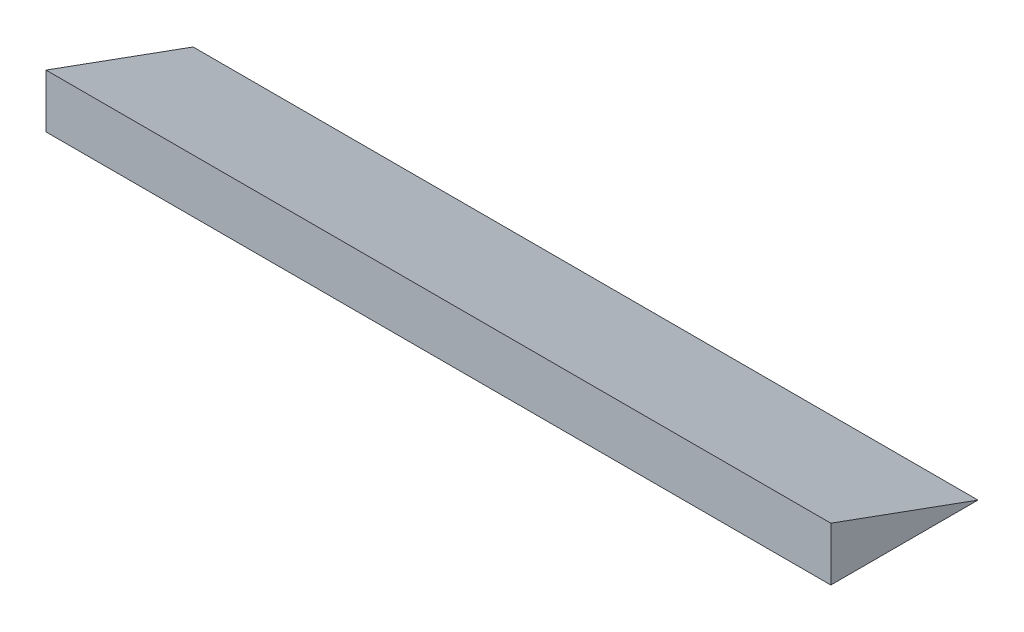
SolidWorks part; units mm, degrees
ref_plane "Plan de face" through (0, 0, 0) normal (0, 0, 1) x (1, 0, 0)
ref_plane "Plan de dessus" through (0, 0, 0) normal (0, 1, 0) x (1, 0, 0)
ref_plane "Plan de droite" through (0, 0, 0) normal (1, 0, 0) x (0, 0, -1)
sketch "Esquisse1" plane through (0, 0, 0) normal (1, 0, 0) x (0, 0, -1)
  line L0 (0, 0) -> (300, 0)
  line L1 (300, 0) -> (0, 109.1911)
  line L2 (0, 0) -> (0, 109.1911)
  dimension "D1" = 20
  dimension "D2" = 300
extrude "Boss.-Extru.1" add sketch "Esquisse1" along normal blind 1600
sketch "Esquisse2" plane through (0, 0, 0) normal (0, -1, 0) x (1, 0, 0)
  line L0 (800, -300) -> (800, 0) construction
  line L1 (1600, -300) -> (0, -300) construction
  line L2 (1600, 0) -> (0, 0) construction
  line L3 (800, -150) -> (258.9561, -150) construction
  circle A0 centre (550, -150) radius 5
  circle A1 centre (1050, -150) radius 5
  dimension "D1" = 250
extrude "Enlèv. mat.-Extru.1" cut sketch "Esquisse2" against normal blind 10
